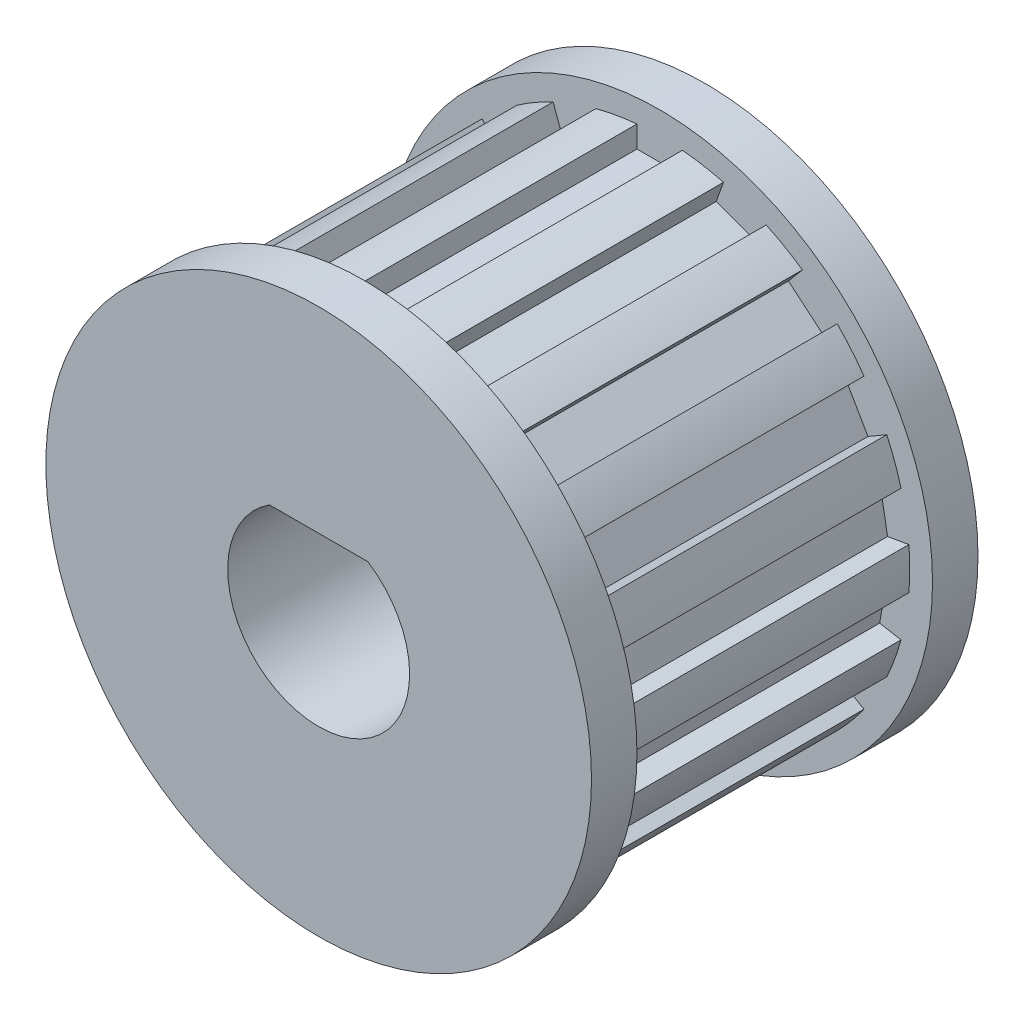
SolidWorks part; units mm, degrees
ref_plane "Plane1" through (0, 0, 0) normal (0, 0, 1) x (1, 0, 0)
ref_plane "Plane2" through (0, 0, 0) normal (0, 1, 0) x (1, 0, 0)
ref_plane "Plane3" through (0, 0, 0) normal (1, 0, 0) x (0, 0, -1)
sketch "Esquisse1" plane through (0, 0, 0) normal (0, 0, 1) x (1, 0, 0)
  circle A0 centre (0, 0) radius 6
  dimension "D1" = 12
extrude "Base-Extrusion" add sketch "Esquisse1" along normal blind 1
sketch "Esquisse2" plane through (0, 0, 1) normal (0, 0, 1) x (1, 0, 0)
  circle A0 centre (0, 0) radius 5.5
  dimension "D1" = 11
extrude "Boss.-Extru.1" add sketch "Esquisse2" along normal blind 6.5
sketch "Esquisse4" plane through (0, 0, 7.5) normal (0, 0, 1) x (1, 0, 0)
  circle A0 centre (0, 0) radius 6
  dimension "D1" = 12
extrude "Boss.-Extru.2" add sketch "Esquisse4" along normal blind 1
sketch "Esquisse5" plane through (0, 0, 8.5) normal (0, 0, 1) x (1, 0, 0)
  line L0 (-1.0815, 1.6824) -> (1.0815, 1.6824)
  arc A0 (-1.0815, 1.6824) -> (1.0815, 1.6824) centre (0, 0) ccw
  dimension "D1" = 4
extrude "Enlèv. mat.-Extru.1" cut sketch "Esquisse5" against normal blind 5
sketch "Esquisse6" plane through (0, 0, 0) normal (0, 0, -1) x (-1, 0, 0)
  circle A0 centre (0, 0) radius 2
  dimension "D1" = 4
extrude "Enlèv. mat.-Extru.2" cut sketch "Esquisse6" against normal blind 3.5
ref_plane "Plan4" through (0, 0, 1) normal (0, 0, 1) x (1, 0, 0)
sketch "Esquisse9" plane through (0, 0, 1) normal (0, 0, 1) x (1, 0, 0)
  line L0 (-0.5, 5) -> (0.5, 5)
  line L1 (-0.5, 5) -> (-0.5, 13)
  line L2 (-0.5, 13) -> (0.5, 13)
  line L3 (0.5, 13) -> (0.5, 5)
  dimension "D1" = 5
  dimension "D2" = 0.5
  dimension "D3" = 0.5
extrude "Enlèv. mat.-Extru.3" cut sketch "Esquisse9" along normal blind 6.5
pattern_circular "Répétition circulaire1" count 18 every 20
sketch "Esquisse10" plane through (0, 0, 0) normal (0, 0, -1) x (-1, 0, 0)
  circle A0 centre (0, 0) radius 4.5
